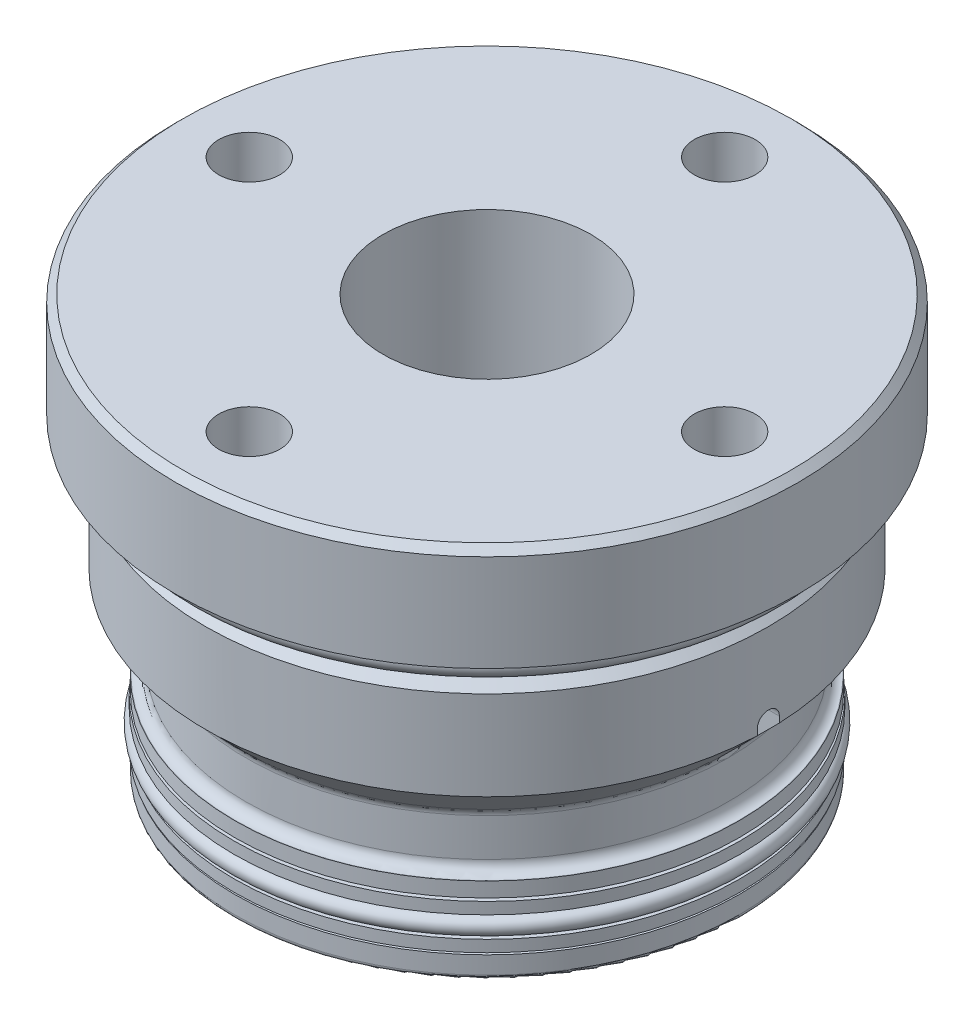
SolidWorks part; units mm, degrees
ref_plane "Front Plane" through (0, 0, 0) normal (0, 0, 1) x (1, 0, 0)
ref_plane "Top Plane" through (0, 0, 0) normal (0, 1, 0) x (1, 0, 0)
ref_plane "Right Plane" through (0, 0, 0) normal (1, 0, 0) x (0, 0, -1)
sketch "Sketch1" plane through (0, 0, 0) normal (0, 0, 1) x (1, 0, 0)
  line L0 (0, 0) -> (0, 29.1031) construction
  line L1 (-22.225, 0) -> (-22.225, 21.4122)
  line L2 (-22.225, 21.4122) -> (-11.1125, 21.4122)
  line L3 (-11.1125, 21.4122) -> (-11.1125, 44.45)
  line L4 (-11.1125, 44.45) -> (-33.274, 44.45)
  line L5 (-33.274, 44.45) -> (-33.274, 33.3502)
  line L6 (-33.274, 33.3502) -> (-30.0863, 33.3502)
  line L7 (-30.0863, 33.3502) -> (-30.0863, 19.2278)
  line L8 (-30.0863, 19.2278) -> (-25.7556, 14.8971)
  line L9 (-25.7556, 14.8971) -> (-25.7556, 9.2202)
  line L10 (-25.7556, 9.2202) -> (-26.9494, 9.2202)
  line L11 (-26.9494, 9.2202) -> (-26.9494, 7.6454)
  line L12 (-26.9494, 7.6454) -> (-25.6921, 7.6454)
  line L13 (-25.6921, 7.6454) -> (-25.6921, 2.3876)
  line L14 (-25.6921, 2.3876) -> (-26.9494, 2.3876)
  line L15 (-26.9494, 2.3876) -> (-26.9494, 0)
  line L16 (-26.9494, 0) -> (-22.225, 0)
  dimension "D1" = 21.4122
  dimension "D2" = 44.45
  dimension "D3" = 66.548
  dimension "D4" = 22.225
  dimension "D5" = 44.45
  dimension "D6" = 53.8988
  dimension "D7" = 2.3876
  dimension "D8" = 1.5748
  dimension "D9" = 51.3842
  dimension "D10" = 5.2578
  dimension "D11" = 33.3502
  dimension "D12" = 60.1726
  dimension "D13" = 51.5112
  dimension "D14" = 19.2278
  dimension "D15" = 45
revolve "Revolve1" add sketch "Sketch1" angle 360 about L0
fillet "Fillet1" radius 1.143 2 edges at (0, 14.8971, -25.7556) (0, 9.2202, -25.7556)
fillet "Fillet2" radius 0.381 2 edges at (0, 7.6454, -25.6921) (0, 2.3876, -25.6921)
fillet "Fillet3" radius 0.508 1 edges at (0, 0, -26.9494)
hole_wizard "Hole1" positions "Sketch3" profile "Sketch2" legacy
sketch "Sketch3" plane through (0, 44.45, 0) normal (0, 1, 0) x (-1, 0, 0)
  circle A0 centre (0, 0) radius 25.4 construction
  point P0 (-25.4, 0)
  dimension "D1" = 25.4
sketch "Sketch2" plane through (25.4, 44.45, 0) normal (1, 0, 0) x (0, 0, 1)
  line L0 (0, 0) -> (0, 8.3111)
  line L1 (0, 8.3111) -> (3.2639, 6.35)
  line L2 (3.2639, 6.35) -> (3.2639, 0)
  line L4 (3.2639, 0) -> (0, 0)
  line L6 (0, 8.3111) -> (-3.2639, 6.35) construction
  line L7 (0, -4.2442) -> (0, 117.3081) construction
  dimension "Diameter" = 6.5278
  dimension "Depth" = 6.35
  dimension "Drill Angle" = 118
pattern_circular "CirPattern1" count 4 over 360 about axis through (0, 0, 0) along (0, 1, 0) of "Hole1"
chamfer "Chamfer1" distance 0.762 angle 45 1 edges at (0, 44.45, -33.274)
sketch "Sketch4" plane through (0, 0, 0) normal (0, 0, 1) x (1, 0, 0)
  line L0 (0, 0) -> (0, 41.4124) construction
  line L1 (-30.0863, 33.3502) -> (-30.0863, 28.7528)
  line L2 (-30.0863, 33.3502) -> (-30.0863, 19.2278) construction
  line L3 (-30.0863, 28.7528) -> (-28.9433, 29.8958)
  line L4 (-28.9433, 29.8958) -> (-28.9433, 33.3502)
  line L5 (-30.0863, 33.3502) -> (30.0863, 33.3502) construction
  line L6 (-28.9433, 33.3502) -> (-30.0863, 33.3502)
  line L7 (30.0863, 19.2278) -> (-30.0863, 19.2278) construction
  dimension "D1" = 57.8866
  dimension "D2" = 9.525
  dimension "D3" = 45
revolve "Cut-Revolve1" cut sketch "Sketch4" angle 360 about L0
fillet "Fillet4" radius 0.381 2 edges at (0, 29.8958, -28.9433) (0, 33.3502, -28.9433)
sketch "Sketch5" plane through (0, 0, 0) normal (0, 0, 1) x (1, 0, 0)
  line L0 (-33.274, 33.3502) -> (33.274, 33.3502) construction
  line L1 (0, 0) -> (0, 42.572) construction
  circle A0 centre (-30.2133, 32.004) radius 1.3081
  dimension "D2" = 2.6162
  dimension "D1" = 1.3462
  dimension "D3" = 60.4266
revolve "Revolve2" add sketch "Sketch5" angle 360 about L1
sketch "Sketch6" plane through (0, 0, 0) normal (0, 0, 1) x (1, 0, 0)
  line L0 (0, 0) -> (0, 49.5791) construction
  line L1 (-25.6921, 7.2644) -> (-25.6921, 2.7686) construction
  line L2 (-25.6921, 6.1468) -> (-27.0383, 6.1468)
  line L3 (-25.6921, 6.1468) -> (-25.6921, 7.3914)
  line L4 (-25.6921, 7.3914) -> (-27.0383, 7.3914)
  line L5 (-27.0383, 6.1468) -> (-27.0383, 7.3914)
  line L6 (-25.6921, 5.0165) -> (-17.8863, 5.0165) construction
  line L7 (-27.0383, 3.8862) -> (-27.0383, 2.6416)
  line L8 (-25.6921, 2.6416) -> (-27.0383, 2.6416)
  line L9 (-25.6921, 3.8862) -> (-25.6921, 2.6416)
  line L10 (-25.6921, 3.8862) -> (-27.0383, 3.8862)
  line L11 (26.9494, 2.3876) -> (-26.9494, 2.3876) construction
  circle A0 centre (-26.5303, 4.9276) radius 0.889
  dimension "D4" = 1.778
  dimension "D5" = 53.0606
  dimension "D6" = 2.54
  dimension "D1" = 1.2446
  dimension "D2" = 54.0766
  dimension "D3" = 2.2606
revolve "Revolve3" add sketch "Sketch6" angle 360 about L0
sketch "Sketch7" plane through (0, 0, 0) normal (1, 0, 0) x (0, 0, -1)
  line L0 (-26.4414, 0) -> (26.4414, 0) construction
  circle A0 centre (0, 19.8628) radius 1.1811
  dimension "D1" = 2.3622
  dimension "D2" = 19.8628
extrude "Cut-Extrude1" cut sketch "Sketch7" against normal through all and the other way through all
sketch "Sketch8" plane through (0, 0, 0) normal (1, 0, 0) x (0, 0, -1)
  line L0 (-1.1811, 19.8628) -> (-1.1811, 15.1003)
  line L1 (0, 19.8628) -> (0, 15.1003) construction
  line L2 (1.1811, 19.8628) -> (1.1811, 15.1003)
  arc A0 (1.1811, 19.8628) -> (-1.1811, 19.8628) centre (0, 19.8628) ccw
  arc A1 (-1.1811, 15.1003) -> (1.1811, 15.1003) centre (0, 15.1003) ccw
  arc A2 (-0.9959, 19.2278) -> (0.9959, 19.2278) centre (0, 19.8628) ccw construction
  dimension "D1" = 4.7625
extrude "Cut-Extrude3" cut sketch "Sketch8" along normal blind 27.686 from offset 25.7556
mirror "Mirror1" about plane through (0, 0, 0) normal (1, 0, 0) of "Cut-Extrude3"
